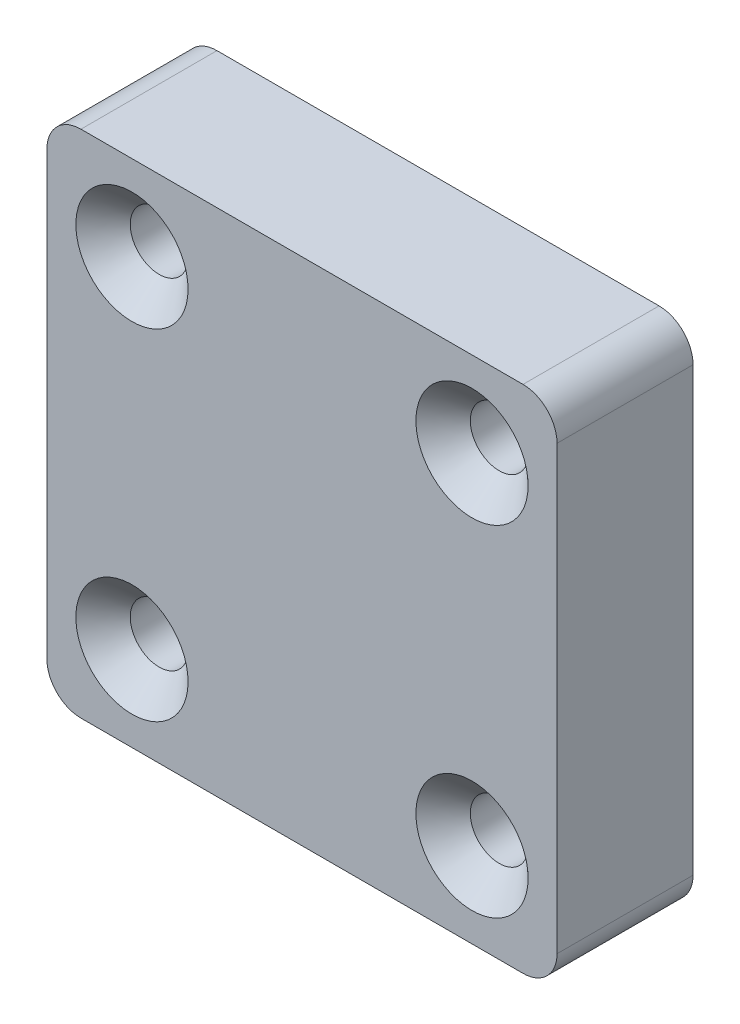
SolidWorks part; units mm, degrees
ref_plane "前视基准面" through (0, 0, 0) normal (0, 0, 1) x (1, 0, 0)
ref_plane "上视基准面" through (0, 0, 0) normal (0, 1, 0) x (1, 0, 0)
ref_plane "右视基准面" through (0, 0, 0) normal (1, 0, 0) x (0, 0, -1)
other "Configuration Table"
sketch "草图1" plane through (0, 0, 0) normal (0, 0, 1) x (1, 0, 0)
  line L1 (-15, 15) -> (15, 15)
  line L2 (-15, 15) -> (-15, -15)
  line L3 (-15, -15) -> (15, -15)
  line L4 (15, 15) -> (15, -15)
  line L5 (-15, 15) -> (15, -15) construction
  line L6 (-15, -15) -> (15, 15) construction
  point P0 (0, 0)
  dimension "D1" = 30
  dimension "D2" = 30
extrude "凸台-拉伸1" add sketch "草图1" along normal blind 10
hole_wizard "M3 十字槽沉头木螺钉的锥形沉头孔1" positions "草图2" profile "草图3" countersink size "M3" standard "GB"
sketch "草图2" plane through (0, 0, 10) normal (0, 0, 1) x (1, 0, 0)
  line L0 (15, 15) -> (-15, 15) construction
  line L1 (-15, 15) -> (-15, -15) construction
  line L2 (-15, -15) -> (15, -15) construction
  line L3 (15, -15) -> (15, 15) construction
  point P0 (-10, 10)
  point P2 (10, 10)
  point P4 (-10, -10)
  point P6 (10, -10)
  dimension "D1" = 5
  dimension "D2" = 5
  dimension "D3" = 5
  dimension "D4" = 5
  dimension "D5" = 5
  dimension "D6" = 5
  dimension "D7" = 5
  dimension "D8" = 5
sketch "草图3" plane through (-10, 10, 10) normal (1, 0, 0) x (0, -1, 0)
  line L0 (0, 0) -> (0, 10)
  line L1 (0, 10) -> (1.7, 10)
  line L2 (1.7, 10) -> (1.7, 1.6)
  line L3 (1.7, 1.6) -> (3.3, 0)
  line L5 (3.3, 0) -> (0, 0)
  line L6 (-1.7, 1.6) -> (-3.3, 0) construction
  line L11 (0, -6.35) -> (0, 107.95) construction
  dimension "通孔孔直径" = 3.4
  dimension "通孔孔深度" = 10
  dimension "近端锥形沉头孔直径" = 6.6
  dimension "近端锥形沉头孔角度" = 90
fillet "圆角1" radius 2 4 edges at (-15, -15, 5) (15, -15, 5) (15, 15, 5) (-15, 15, 5)
sketch "草图4" plane through (0, 0, 0) normal (0, 0, -1) x (-1, 0, 0)
  line L4 (-13, -15) -> (13, -15)
  line L5 (15, -13) -> (15, 13)
  line L6 (13, 15) -> (-13, 15)
  line L7 (-15, 13) -> (-15, -13)
  line L8 (-13, -15) -> (13, -15)
  line L9 (15, -13) -> (15, 13)
  line L10 (13, 15) -> (-13, 15)
  line L11 (-15, 13) -> (-15, -13)
  arc A4 (13, -15) -> (15, -13) centre (13, -13) ccw
  arc A5 (15, 13) -> (13, 15) centre (13, 13) ccw
  arc A6 (-13, 15) -> (-15, 13) centre (-13, 13) ccw
  arc A7 (-15, -13) -> (-13, -15) centre (-13, -13) ccw
  arc A8 (13, -15) -> (15, -13) centre (13, -13) ccw
  arc A9 (15, 13) -> (13, 15) centre (13, 13) ccw
  arc A10 (-13, 15) -> (-15, 13) centre (-13, 13) ccw
  arc A11 (-15, -13) -> (-13, -15) centre (-13, -13) ccw
  dimension "D1" = 0
extrude "切除-拉伸1" cut sketch "草图4" against normal blind 2
